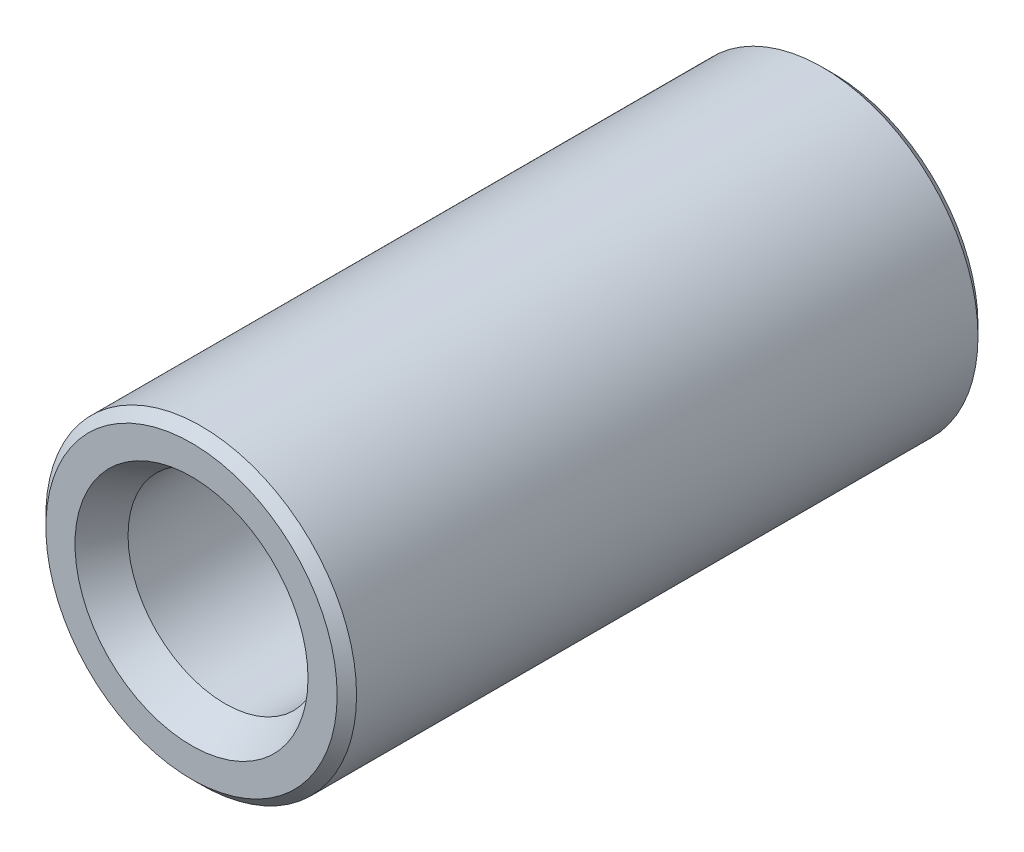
SolidWorks part; units mm, degrees
ref_plane "Plan1" through (0, 0, 0) normal (0, 0, 1) x (1, 0, 0)
ref_plane "Plan2" through (0, 0, 0) normal (0, 1, 0) x (1, 0, 0)
ref_plane "Plan3" through (0, 0, 0) normal (1, 0, 0) x (0, 0, -1)
sketch "Esquisse1" plane through (0, 0, 0) normal (0, 0, 1) x (1, 0, 0)
  circle A0 centre (0, 0) radius 5
  circle A1 centre (0, 0) radius 8
  dimension "D1" = 10
  dimension "D2" = 16
extrude "Base-Extrusion" add sketch "Esquisse1" along normal blind 33
chamfer "Chanfrein1" distance 1 angle 60
chamfer "Chanfrein2" distance 0.5 angle 45
